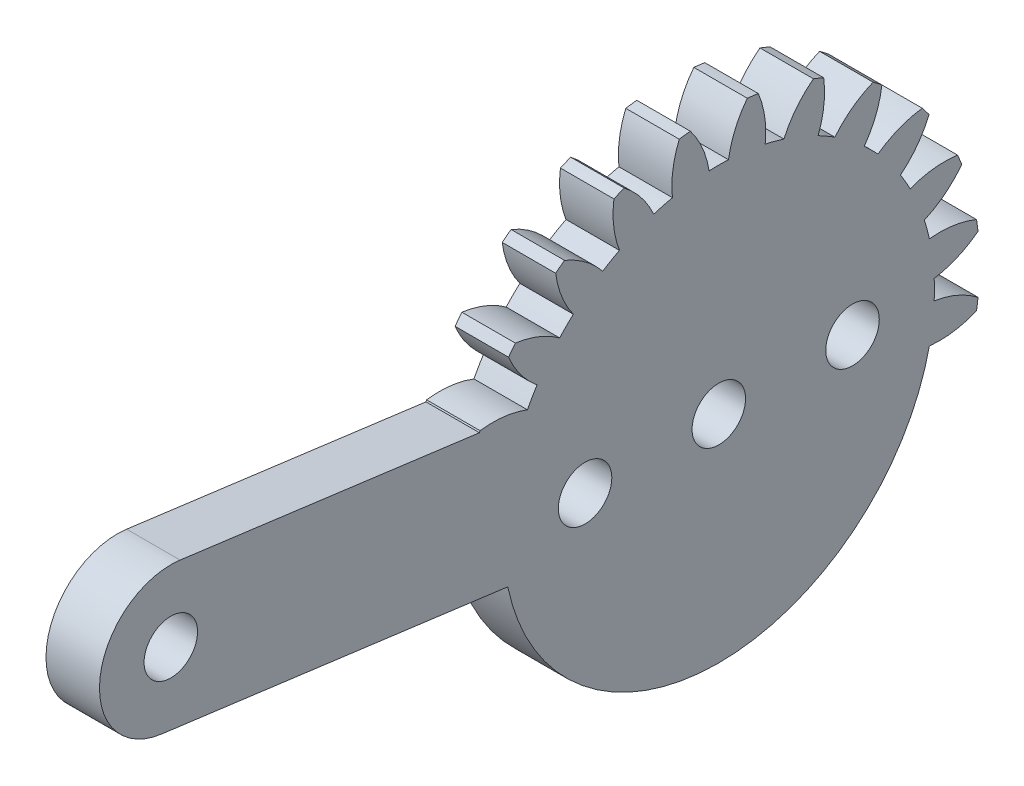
SolidWorks part; units mm, degrees
ref_plane "Front Plane" through (0, 0, 0) normal (0, 0, 1) x (1, 0, 0)
ref_plane "Top Plane" through (0, 0, 0) normal (0, 1, 0) x (1, 0, 0)
ref_plane "Right Plane" through (0, 0, 0) normal (1, 0, 0) x (0, 0, -1)
imported_body "spur gear_iso-2-solid1"
hole_wizard "Ø3.0 (3) Diameter Hole1" positions "Sketch2" profile "Sketch3" hole size "Ø3.0" standard "ISO"
sketch "Sketch2" plane through (3, 0, 0) normal (1, 0, 0) x (0, 0, -1)
  point P0 (0, 0)
sketch "Sketch3" plane through (3, 0, 0) normal (0, 1, 0) x (0, 0, -1)
  line L0 (0, 0) -> (0, 3)
  line L1 (0, 3) -> (1.5, 3)
  line L2 (1.5, 3) -> (1.5, 0)
  line L5 (1.5, 0) -> (0, 0)
  line L11 (0, -6.35) -> (0, 107.95) construction
  dimension "Thru Hole Dia." = 3
  dimension "Thru Hole Depth" = 3
sketch "Sketch4" plane through (3, 0, 0) normal (1, 0, 0) x (0, 0, -1)
  line L0 (0, 0) -> (-30.7348, 4.0463) construction
  line L1 (-0.5221, -3.9658) -> (-31.2569, 0.0805)
  line L2 (0.5221, 3.9658) -> (-30.2127, 8.0121)
  line L3 (0, 0) -> (1.9089, 14.4999) construction
  arc A0 (-0.5221, -3.9658) -> (0.5221, 3.9658) centre (0, 0) ccw
  arc A1 (-30.2127, 8.0121) -> (-31.2569, 0.0805) centre (-30.7348, 4.0463) ccw
  circle A2 centre (-30.7348, 4.0463) radius 1.5
  arc A3 (2.2179, 14.4558) -> (1.5991, 14.5373) centre (0, 0) ccw construction
  point P3 (-15.3674, 2.0232)
  dimension "D3" = 3
  dimension "D1" = 8
  dimension "D2" = 31
extrude "Boss-Extrude1" add sketch "Sketch4" against normal blind 3
hole_wizard "Ø3.0 (3) Diameter Hole2" positions "Sketch5" profile "Sketch6" hole size "Ø3.0" standard "ISO"
sketch "Sketch5" plane through (3, 0, 0) normal (1, 0, 0) x (0, 0, -1)
  point P0 (0, 0)
sketch "Sketch6" plane through (3, 0, 0) normal (0, 1, 0) x (0, 0, -1)
  line L0 (0, 0) -> (0, 3)
  line L1 (0, 3) -> (1.5, 3)
  line L2 (1.5, 3) -> (1.5, 0)
  line L5 (1.5, 0) -> (0, 0)
  line L11 (0, -6.35) -> (0, 107.95) construction
  dimension "Thru Hole Dia." = 3
  dimension "Thru Hole Depth" = 3
sketch "Sketch7" plane through (3, 0, 0) normal (1, 0, 0) x (0, 0, -1)
  line L0 (-31.2569, 0.0805) -> (-14.4691, -2.1296) construction
  line L1 (-16.7937, -1.8236) -> (-11.8365, -2.4762)
  circle A0 centre (0, 0) radius 12.0927 construction
  arc A1 (-10.1907, 6.5103) -> (-10.7334, 5.5703) centre (0, 0) ccw construction
  arc A2 (-11.8365, -2.4762) -> (11.8094, -2.6025) centre (0, 0) ccw
  dimension "D1" = 5
extrude "Cut-Extrude1" cut sketch "Sketch7" against normal blind 3 and the other way through all flip side to cut
sketch "Sketch8" plane through (3, 0, 0) normal (1, 0, 0) x (0, 0, -1)
  line L0 (-7.5, -0.0919) -> (7.5, 0.0919) construction
  circle A0 centre (-7.5, -0.0919) radius 1.5
  circle A1 centre (7.5, 0.0919) radius 1.5
  dimension "D1" = 3
  dimension "D2" = 15
extrude "Cut-Extrude2" cut sketch "Sketch8" against normal blind 3
